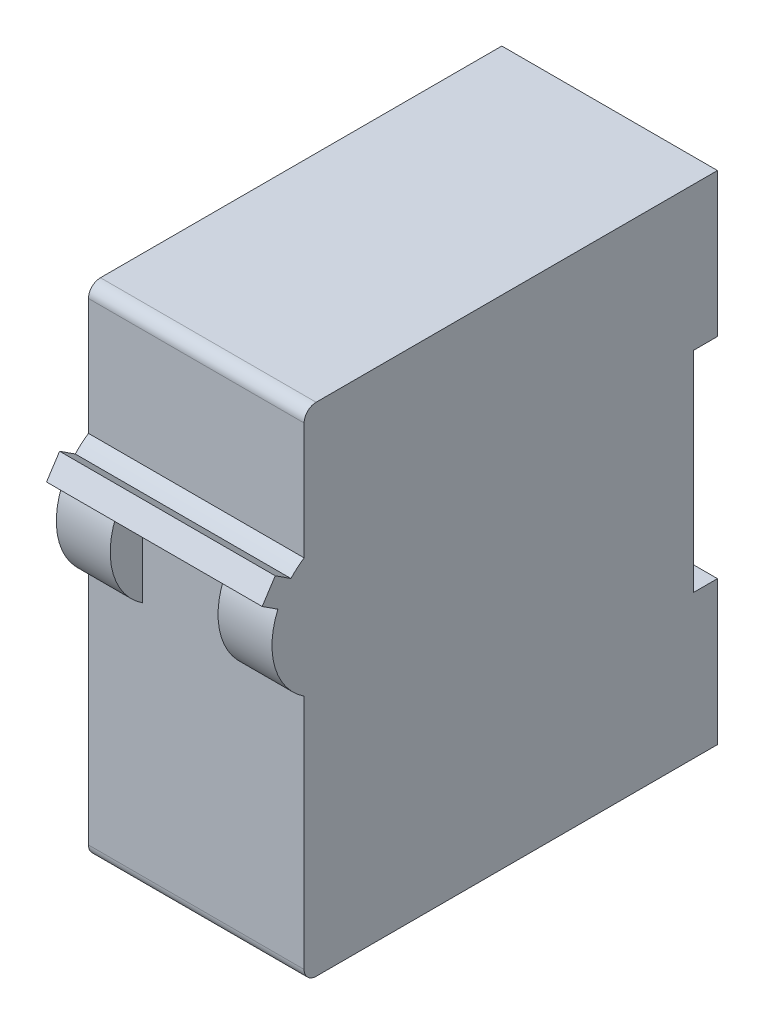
SolidWorks part; units mm, degrees
ref_plane "Plan de face" through (0, 0, 0) normal (0, 0, 1) x (1, 0, 0)
ref_plane "Plan de dessus" through (0, 0, 0) normal (0, 1, 0) x (1, 0, 0)
ref_plane "Plan de droite" through (0, 0, 0) normal (1, 0, 0) x (0, 0, -1)
sketch "EW_SKETCH" plane through (0, 0, 0) normal (1, 0, 0) x (0, 0, -1)
  line L0 (0, 83) -> (0, 59)
  line L1 (0, 83) -> (-69, 83)
  line L2 (-69, 83) -> (-69, 61.5)
  line L3 (0, 59) -> (-4, 59)
  line L4 (-4, 59) -> (-4, 24)
  line L5 (-4, 24) -> (0, 24)
  line L6 (0, 24) -> (0, 0)
  line L7 (-69, 41.5) -> (-69, 0)
  line L8 (-69, 0) -> (0, 0)
  line L9 (-71.2008, 59.6216) -> (-73.8214, 61.3235)
  line L10 (-73.8214, 61.3235) -> (-76, 57.9688)
  line L11 (-76, 57.9688) -> (-73.3793, 56.2669)
  line L12 (-74.9107, 59.6462) -> (-62.3668, 51.5) construction
  line L13 (-4, 41.5) -> (-69, 41.5) construction
  arc A0 (-73.3793, 56.2669) -> (-69, 41.5) centre (-62.3668, 51.5) ccw
  arc A1 (-71.2008, 59.6216) -> (-69, 61.5) centre (-62.3668, 51.5) cw
extrude "EW_EXTRUDE" add sketch "EW_SKETCH" along normal blind 36
fillet "Congé1" radius 2 2 edges at (18, 0, 69) (18, 83, 69)
sketch "Esquisse2" plane through (0, 0, 69) normal (0, 0, 1) x (1, 0, 0)
  line L0 (36, 41.5) -> (0, 41.5) construction
  line L1 (27, 41.5) -> (9, 41.5)
  line L2 (27, 41.5) -> (27, 56.2669)
  line L3 (27, 56.2669) -> (9, 56.2669)
  line L4 (9, 41.5) -> (9, 56.2669)
  line L5 (36, 56.2669) -> (0, 56.2669) construction
  line L6 (0, 41.5) -> (0, 2) construction
  point P8 (18, 41.5)
extrude "Extrusion2" cut sketch "Esquisse2" along normal through all
equation "\"d_rail@EW_SKETCH\"=4"
equation "\"D1@Esquisse2\" = \"EW_WIDTH@EW_EXTRUDE\" / 4"
